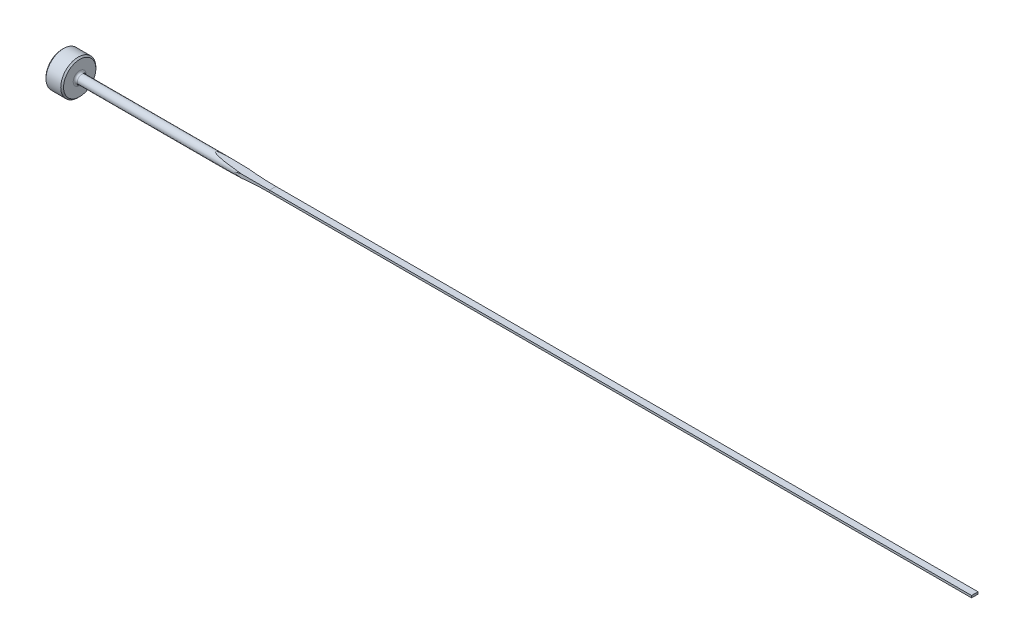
SolidWorks part; units mm, degrees
ref_plane "Front Plane" through (0, 0, 0) normal (0, 0, 1) x (1, 0, 0)
ref_plane "Top Plane" through (0, 0, 0) normal (0, 1, 0) x (1, 0, 0)
ref_plane "Right Plane" through (0, 0, 0) normal (1, 0, 0) x (0, 0, -1)
sketch "Sketch1" plane through (0, 0, 0) normal (0, 0, 1) x (1, 0, 0)
  line L0 (0, 0) -> (167.7268, 0) construction
  line L1 (0, 0) -> (0, 3.175)
  line L2 (0, 3.175) -> (3.175, 3.175)
  line L3 (3.175, 3.175) -> (3.175, 0.7938)
  line L4 (3.175, 0.7938) -> (165.1, 0.7937)
  line L5 (165.1, 0.7937) -> (165.1, 0)
  line L6 (165.1, 0) -> (0, 0)
  dimension "D1" = 165.1
  dimension "D2" = 6.35
  dimension "D3" = 1.5875
  dimension "D4" = 3.175
revolve "Revolve1" add sketch "Sketch1" angle 360 about L0
sketch "Sketch2" plane through (0, 0, 0) normal (0, 0, 1) x (1, 0, 0)
  line L0 (165.1, 0.7938) -> (165.1, 0.1905)
  line L1 (165.1, -0.7937) -> (165.1, 0.7937) construction
  line L2 (165.1, 0.1905) -> (38.1, 0.1905)
  line L3 (165.1, 0.7938) -> (3.175, 0.7938) construction
  line L4 (27.761, 0.7937) -> (165.1, 0.7938)
  line L5 (166.0833, 0) -> (153.1705, 0) construction
  arc A0 (38.1, 0.1905) -> (27.761, 0.7937) centre (38.1, 89.0905) cw
  dimension "D1" = 88.9
  dimension "D3" = 127
  dimension "D2" = 0.381
  dimension "D4" = 10.339
extrude "Cut-Extrude1" cut sketch "Sketch2" against normal through all both and the other way through all
mirror "Mirror1" about plane through (0, 0, 0) normal (0, 1, 0) of "Cut-Extrude1"
sketch "Sketch3" plane through (0, 0, 0) normal (0, 1, 0) x (1, 0, 0)
  line L0 (165.1, 0.7938) -> (165.1, 0.5842)
  line L1 (165.1, 0.7706) -> (165.1, -0.7706) construction
  line L2 (165.1, 0.5842) -> (38.1, 0.5842)
  line L3 (165.1, 0.7938) -> (3.175, 0.7938) construction
  line L4 (31.9997, 0.7937) -> (165.1, 0.7938)
  line L5 (163.4716, 0) -> (166.2513, 0) construction
  line L6 (38.1, 0.7706) -> (38.1, -0.7706) construction
  arc A0 (38.1, 0.5842) -> (31.9997, 0.7937) centre (38.1, 89.4842) cw
  dimension "D2" = 88.9
  dimension "D1" = 1.1684
extrude "Cut-Extrude2" cut sketch "Sketch3" against normal through all both and the other way through all
mirror "Mirror2" about plane through (0, 0, 0) normal (0, 0, 1) of "Cut-Extrude2"
fillet "Fillet1" radius 0.381 1 edges at (3.175, 0, 0.7938)
chamfer "Chamfer1" distance 0.254 angle 45 2 edges at (0, 0, 3.175) (3.175, 0, 3.175)
